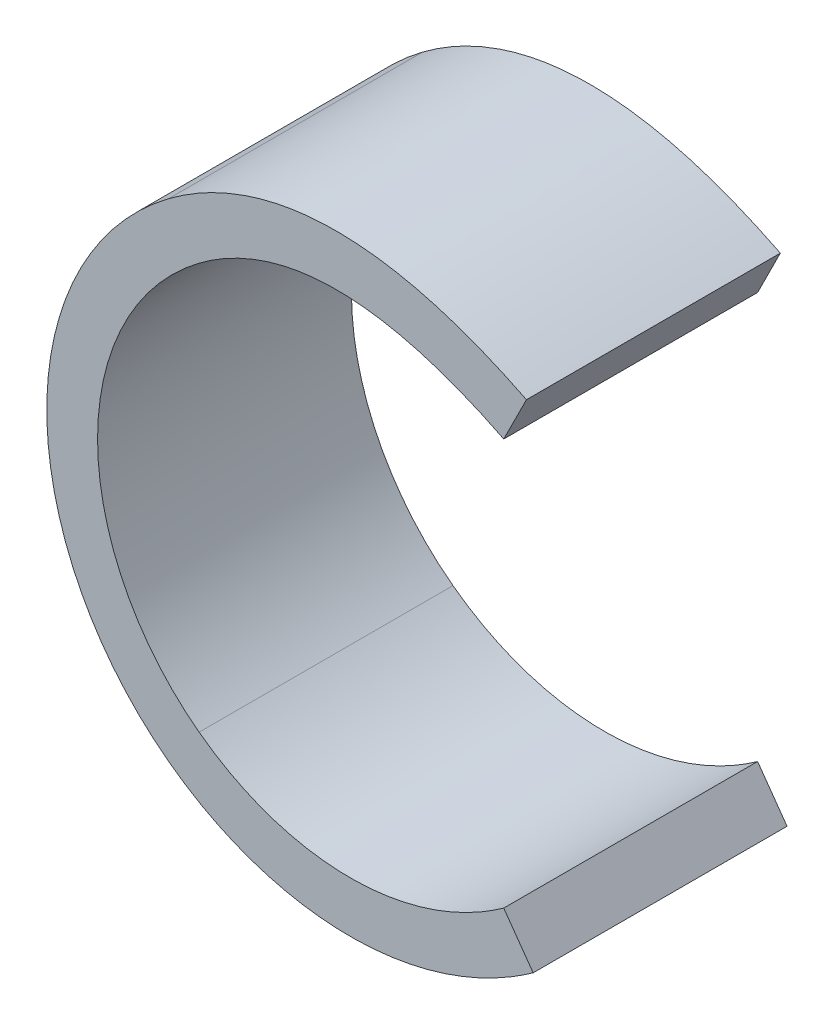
SolidWorks part; units mm, degrees
ref_plane "Front Plane" through (0, 0, 0) normal (0, 0, 1) x (1, 0, 0)
ref_plane "Top Plane" through (0, 0, 0) normal (0, 1, 0) x (1, 0, 0)
ref_plane "Right Plane" through (0, 0, 0) normal (1, 0, 0) x (0, 0, -1)
sketch "Sketch1"
  dimension "D1" = 100
  dimension "D2" = 60
extrude "Extrude-Thin1" add sketch "Sketch1" along normal blind 50 thin
